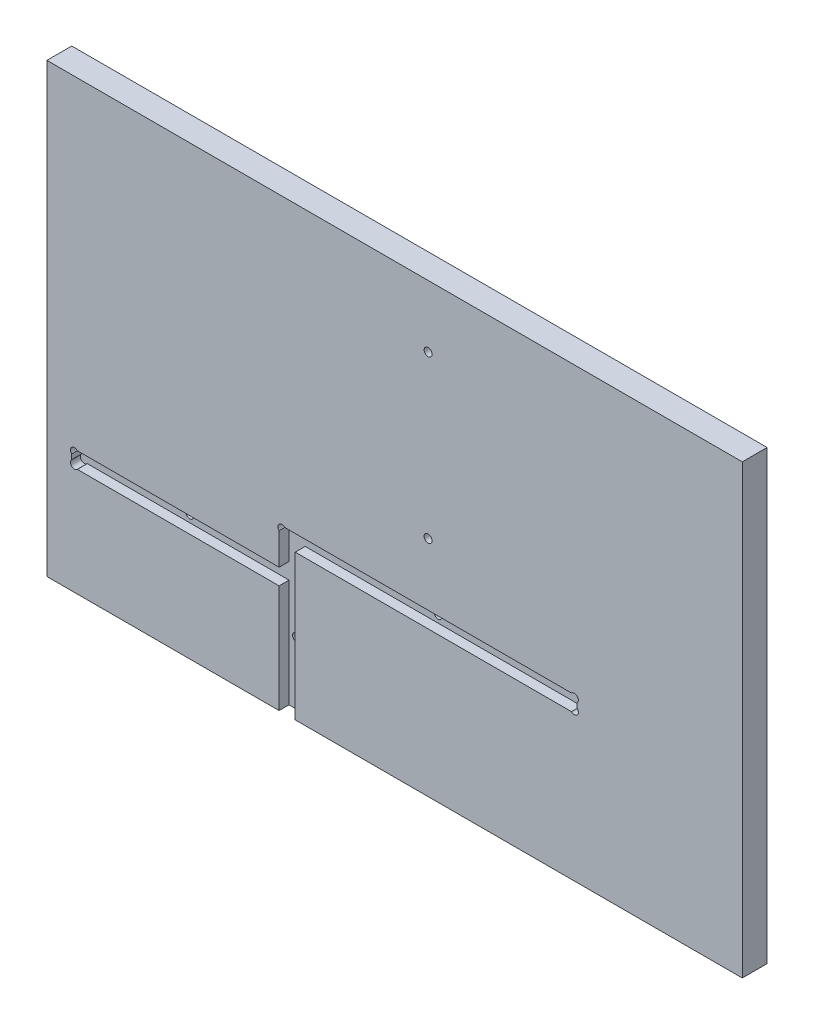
SolidWorks part; units mm, degrees
ref_plane "Plan de face" through (0, 0, 0) normal (0, 0, 1) x (1, 0, 0)
ref_plane "Plan de dessus" through (0, 0, 0) normal (0, 1, 0) x (1, 0, 0)
ref_plane "Plan de droite" through (0, 0, 0) normal (1, 0, 0) x (0, 0, -1)
sketch "Esquisse1" plane through (0, 0, 0) normal (0, 0, 1) x (1, 0, 0)
  line L1 (-70, 40) -> (210, 40)
  line L2 (-70, 40) -> (-70, -140)
  line L3 (-70, -140) -> (210, -140)
  line L4 (210, 40) -> (210, -140)
  dimension "D1" = 280
  dimension "D2" = 180
extrude "Extrusion1" add sketch "Esquisse1" along normal blind 10
sketch "Esquisse2" plane through (0, 0, 10) normal (0, 0, 1) x (1, 0, 0)
  line L1 (23.5, -75) -> (143.5, -75)
  line L2 (23.5, -75) -> (23.5, -81.5)
  line L3 (23.5, -81.5) -> (143.5, -81.5)
  line L4 (143.5, -75) -> (143.5, -81.5)
  line L5 (-60, -90) -> (30, -90)
  line L6 (-60, -90) -> (-60, -96.5)
  line L7 (-60, -96.5) -> (30, -96.5)
  line L8 (30, -90) -> (30, -96.5)
  line L9 (-70, 40) -> (-70, -140) construction
  line L10 (-70, -140) -> (210, -140) construction
  dimension "D1" = 90
  dimension "D2" = 6.5
  dimension "D3" = 6.5
  dimension "D4" = 120
  dimension "D5" = 65
  dimension "D6" = 50
  dimension "D7" = 10
  dimension "D8" = 6.5
extrude "Enlèv. mat.-Extru.1" cut sketch "Esquisse2" against normal blind 4
sketch "Esquisse3" plane through (0, 0, 10) normal (0, 0, 1) x (1, 0, 0)
  line L0 (143.5, -81.5) -> (143.5, -75) construction
  line L1 (143.5, -75) -> (23.5, -75) construction
  line L2 (23.5, -81.5) -> (143.5, -81.5) construction
  line L3 (23.5, -75) -> (23.5, -81.5) construction
  line L5 (30, -90) -> (-60, -90) construction
  line L6 (-60, -96.5) -> (30, -96.5) construction
  line L7 (-60, -90) -> (-60, -96.5) construction
  circle A0 centre (142.4, -76.1) radius 1.6
  circle A1 centre (142.4, -80.4) radius 1.6
  circle A2 centre (24.6, -76.1) radius 1.6
  circle A6 centre (-58.9, -91.1) radius 1.6
  circle A7 centre (-58.9, -95.4) radius 1.6
  dimension "D1" = 1.1
  dimension "D13" = 1.1
  dimension "D2" = 1.1
  dimension "D3" = 1.1
  dimension "D4" = 1.1
  dimension "D7" = 1.1
  dimension "D8" = 1.1
  dimension "D14" = 1.1
  dimension "D15" = 1.1
  dimension "D16" = 1.1
extrude "Enlèv. mat.-Extru.2" cut sketch "Esquisse3" against normal blind 4
sketch "Esquisse4" plane through (0, 0, 10) normal (0, 0, 1) x (1, 0, 0)
  line L0 (210, 40) -> (-70, 40) construction
  line L1 (141.2381, -75) -> (25.7619, -75) construction
  circle A0 centre (83.5, -50) radius 1.6
  circle A1 centre (83.5, 15) radius 1.6
  dimension "D1" = 25
  dimension "D2" = 25
  dimension "D3" = 60
  dimension "D4" = 60
extrude "Enlèv. mat.-Extru.3" cut sketch "Esquisse4" against normal through all
sketch "Esquisse5" plane through (0, 0, 10) normal (0, 0, 1) x (1, 0, 0)
  line L0 (-70, -140) -> (210, -140) construction
  line L1 (23.5, -81.5) -> (30, -81.5)
  line L2 (23.5, -81.5) -> (23.5, -140)
  line L3 (23.5, -140) -> (30, -140)
  line L4 (30, -81.5) -> (30, -140)
  dimension "D1" = 6.5
extrude "Enlèv. mat.-Extru.4" cut sketch "Esquisse5" against normal blind 4
sketch "Esquisse6" plane through (0, 0, 6) normal (0, 0, 1) x (1, 0, 0)
  line L0 (30, -81.5) -> (141.2381, -81.5) construction
  line L1 (23.5, -96.5) -> (23.5, -140) construction
  line L2 (-70, -140) -> (23.5, -140) construction
  line L3 (23.5, -77.2619) -> (23.5, -90) construction
  line L4 (-57.7381, -96.5) -> (23.5, -96.5) construction
  circle A0 centre (83.5, -78.5) radius 1.6
  circle A1 centre (26.5, -115) radius 1.6
  circle A2 centre (-16.5, -93.5) radius 1.6
  point P12 (23.5, -83.6309)
  dimension "D1" = 3
  dimension "D2" = 3
  dimension "D3" = 25
  dimension "D4" = 40
  dimension "D5" = 60
  dimension "D6" = 3
extrude "Enlèv. mat.-Extru.5" cut sketch "Esquisse6" against normal through all
